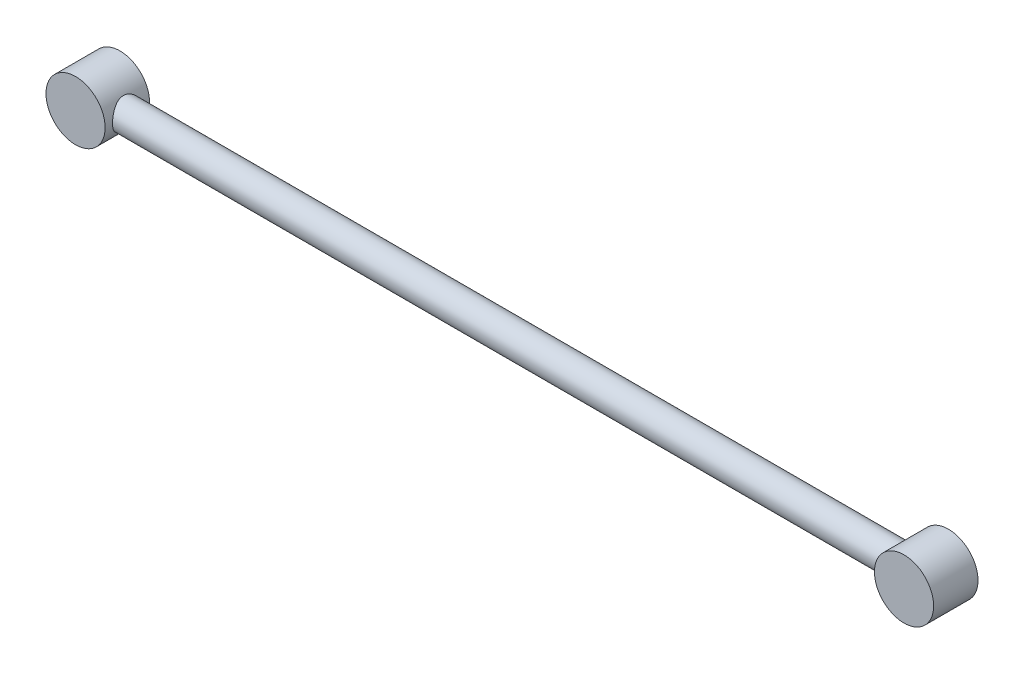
SolidWorks part; units mm, degrees
ref_plane "Front Plane" through (0, 0, 0) normal (0, 0, 1) x (1, 0, 0)
ref_plane "Top Plane" through (0, 0, 0) normal (0, 1, 0) x (1, 0, 0)
ref_plane "Right Plane" through (0, 0, 0) normal (1, 0, 0) x (0, 0, -1)
sketch "Sketch1" plane through (0, 0, 0) normal (0, 0, 1) x (1, 0, 0)
  circle A0 centre (-177.8, 0) radius 12.7
  circle A1 centre (177.8, 0) radius 12.7
  dimension "D1" = 25.4
  dimension "D2" = 355.6
  dimension "D3" = 177.8
extrude "Boss-Extrude1" add sketch "Sketch1" along normal mid plane 19.05
sketch "Sketch2" plane through (0, 0, 0) normal (1, 0, 0) x (0, 0, -1)
  circle A0 centre (0, 0) radius 6.35
  dimension "D1" = 12.7
extrude "Boss-Extrude2" add sketch "Sketch2" along normal up to next and the other way up to next
sketch "Sketch4" plane through (0, 0, 0) normal (0, 1, 0) x (1, 0, 0)
  point P0 (-63.5, 0)
  point P1 (63.5, 0)
  dimension "D1" = 63.5
  dimension "D2" = 63.5
sketch "Sketch5" plane through (0, 0, 0) normal (0, 1, 0) x (1, 0, 0)
  line L0 (-177.8, 0) -> (177.8, 0) construction
  dimension "D1" = 355.6
